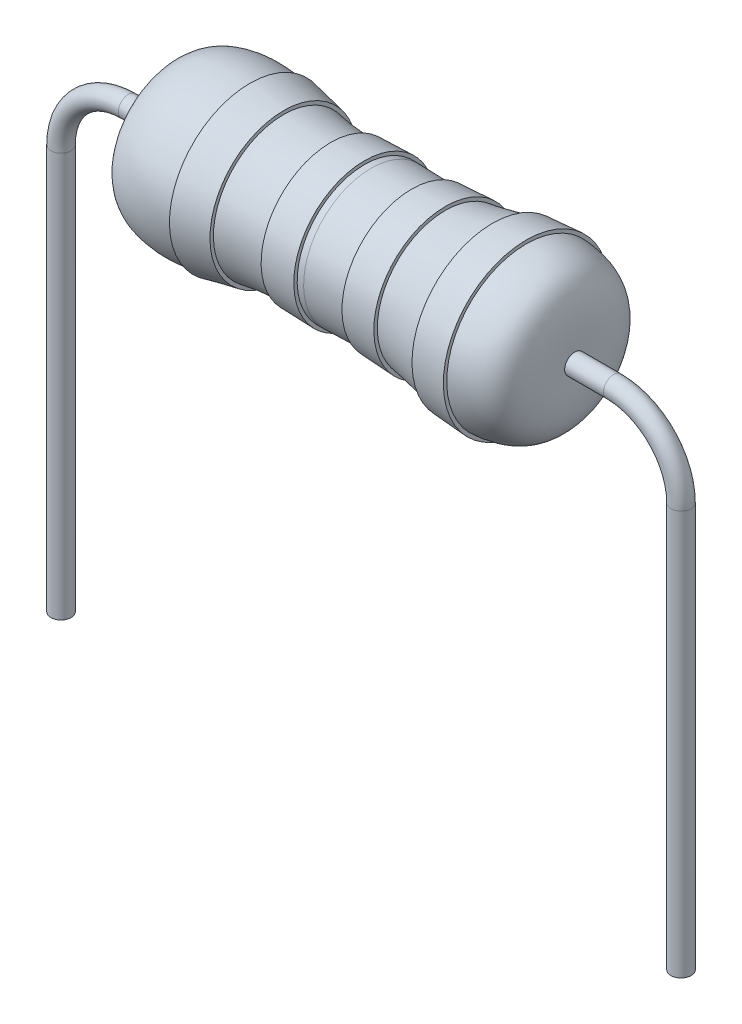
SolidWorks part; units mm, degrees
ref_plane "Plan de face" through (0, 0, 0) normal (0, 0, 1) x (1, 0, 0)
ref_plane "Plan de dessus" through (0, 0, 0) normal (0, 1, 0) x (1, 0, 0)
ref_plane "Plan de droite" through (0, 0, 0) normal (1, 0, 0) x (0, 0, -1)
sketch "Esquisse1" plane through (0, 0, 0) normal (0, 0, 1) x (1, 0, 0)
  line L0 (-3, 0) -> (3, 0) construction
  line L1 (0, 0) -> (0, 2.6167) construction
  line L2 (3.1, 0) -> (-3.1, 0)
  line L3 (-3.8693, 0) -> (4.2011, 0) construction
  line L4 (-3.1, 0.15) -> (-3.0236, 0.15)
  line L5 (3.1, 0.15) -> (3.1, 0)
  line L6 (-3.1, 0.15) -> (-3.1, 0)
  line L7 (3.0236, 0.15) -> (3.1, 0.15)
  line L8 (2.3026, 1.1791) -> (2.3026, 1.2291)
  line L9 (1.8026, 1.1944) -> (1.8026, 1.1437)
  line L10 (1.1026, 1.0606) -> (1.1026, 1.0094)
  line L11 (0.6026, 1.0333) -> (0.6026, 0.9837)
  line L12 (-0.0974, 1.0485) -> (-0.0974, 0.9983)
  line L13 (-1.7974, 1.1935) -> (-1.2974, 1.0923)
  line L14 (-0.5974, 1.0334) -> (-0.0974, 1.0485)
  line L15 (0.6026, 1.0333) -> (1.1026, 1.0606)
  line L16 (1.8026, 1.1944) -> (2.3026, 1.2291)
  line L18 (-0.5974, 1.0334) -> (-0.5974, 0.9837)
  line L21 (-1.2974, 1.0923) -> (-1.2974, 1.0412)
  line L23 (-1.7974, 1.1935) -> (-1.7974, 1.1428)
  point P7 (0, 1)
  point P12 (-2.3026, 1.1791)
  point P16 (-1.0233, 1)
  point P24 (2.8439, 1)
  point P28 (-2.8439, 1)
  dimension "D1" = 3.1
  dimension "D2" = 3
  dimension "D3" = 3.1
  dimension "D4" = 0.15
  dimension "D6" = 0.5
  dimension "D7" = 0.5
  dimension "D8" = 0.7
  dimension "D9" = 0.5
  dimension "D10" = 0.7
  dimension "D11" = 0.5
  dimension "D13" = 0.7
revolve "Révolution2" add sketch "Esquisse1" angle 360 about L2
sketch "Esquisse2" plane through (3.1, 0, 0) normal (1, 0, 0) x (0, 0, -1)
  circle A1 centre (0, 0) radius 0.15
  circle A2 centre (0, 0) radius 0.15
  dimension "D1" = 0
sketch "Esquisse3" plane through (0, 0, 0) normal (0, 0, 1) x (1, 0, 0)
  line L1 (3.1, 0) -> (3.6, 0)
  line L2 (3.1, -0.15) -> (3.1, 0.15) construction
  line L3 (4.6, -1) -> (4.6, -7)
  arc A0 (4.6, -1) -> (3.6, 0) centre (3.6, -1) ccw
  point P8 (4.6, 0)
  dimension "D3" = 1
  dimension "D1" = 7
  dimension "D2" = 1.5
sweep "Balayage1" add profiles "Esquisse2" path "Esquisse3"
mirror "Symétrie1" about plane through (0, 0, 0) normal (1, 0, 0) of "Balayage1"
